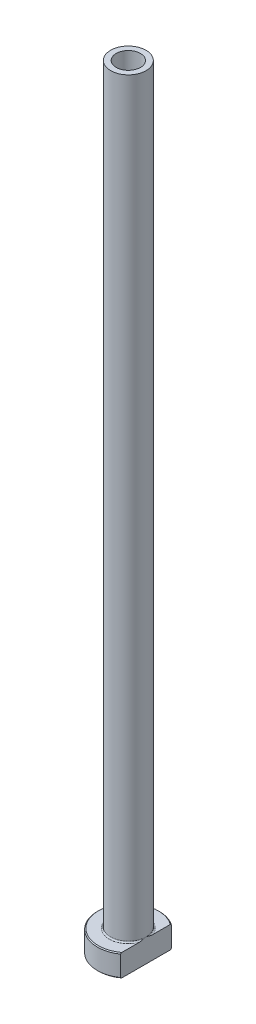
SolidWorks part; units mm, degrees
ref_plane "Front Plane" through (0, 0, 0) normal (0, 0, 1) x (1, 0, 0)
ref_plane "Top Plane" through (0, 0, 0) normal (0, 1, 0) x (1, 0, 0)
ref_plane "Right Plane" through (0, 0, 0) normal (1, 0, 0) x (0, 0, -1)
sketch "Sketch1" plane through (0, 0, 0) normal (0, 0, 1) x (1, 0, 0)
  line L0 (-2.75, 175) -> (-4, 175)
  line L1 (-4, 175) -> (-4, 5)
  line L2 (-4, 5) -> (-7, 5)
  line L3 (-7, 5) -> (-7, 0)
  line L4 (6.05, 0) -> (-6.05, 0) construction
  line L5 (-7, 0) -> (-3, 0)
  line L6 (-2.75, 130) -> (-2.75, 175)
  line L7 (0, 92.1877) -> (0, -15.5353) construction
  line L8 (0, -7.7) -> (0, 7.7) construction
  line L9 (-2.75, 130) -> (-3, 118)
  line L10 (-3, 118) -> (-3, 0)
  dimension "D1" = 0.25
  dimension "ID" = 5.5
  dimension "OD" = 8
  dimension "L" = 175
  dimension "H" = 14
  dimension "T" = 5
  dimension "N" = 45
  dimension "D2" = 12
  dimension "L-N" = 130
revolve "Revolve1" add sketch "Sketch1" angle 360 about L7
fillet "Fillet1" radius 0.3 1 edges at (0, 5, 4)
chamfer "Chamfer1" distance 0.2 angle 45 2 edges at (0, 5, 7) (0, 0, 7)
sketch "Sketch2" plane through (0, 0, 0) normal (0, -1, 0) x (1, 0, 0)
  line L0 (4, 5.7446) -> (4, -5.7446)
  circle A0 centre (0, 0) radius 7 construction
  arc A1 (4, 5.7446) -> (4, -5.7446) centre (0, 0) cw
  circle A2 centre (0, 0) radius 4 construction
extrude "Cut-Extrude1" cut sketch "Sketch2" against normal through all
chamfer "Chamfer2" distance 0.5 angle 45 1 edges at (0, 0, 3)
